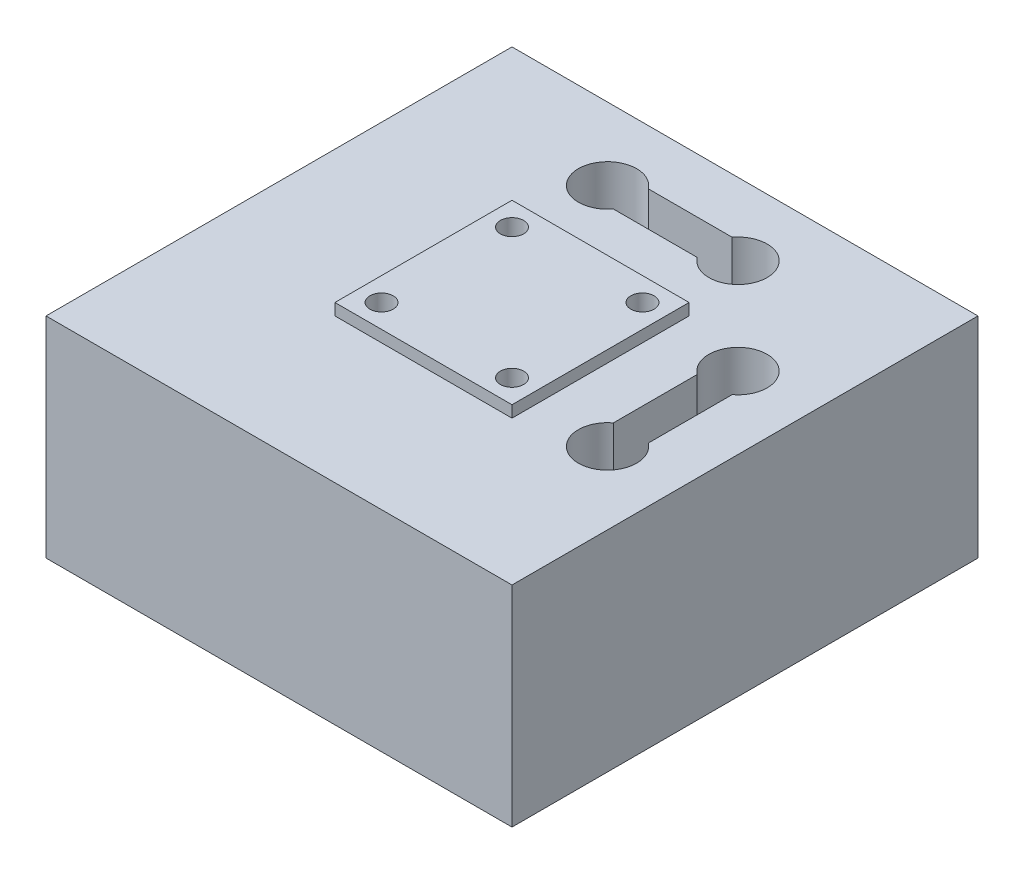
SolidWorks part; units mm, degrees
ref_plane "Front Plane" through (0, 0, 0) normal (0, 0, 1) x (1, 0, 0)
ref_plane "Top Plane" through (0, 0, 0) normal (0, 1, 0) x (1, 0, 0)
ref_plane "Right Plane" through (0, 0, 0) normal (1, 0, 0) x (0, 0, -1)
sketch "Sketch1" plane through (0, 0, 0) normal (0, 1, 0) x (1, 0, 0)
  line L1 (0, 0) -> (40, 0)
  line L2 (0, 0) -> (0, 40)
  line L3 (0, 40) -> (40, 40)
  line L4 (40, 0) -> (40, 40)
  dimension "D1" = 40
extrude "Boss-Extrude1" add sketch "Sketch1" along normal blind 18
sketch "Sketch2" plane through (0, 18, 0) normal (0, 1, 0) x (1, 0, 0)
  line L0 (0, 27.6) -> (12.4, 27.6) construction
  line L1 (12.4, 12.4) -> (27.6, 12.4)
  line L2 (12.4, 12.4) -> (12.4, 27.6)
  line L3 (12.4, 27.6) -> (27.6, 27.6)
  line L4 (27.6, 12.4) -> (27.6, 27.6)
  line L5 (0, 40) -> (0, 0) construction
  line L6 (12.4, 27.6) -> (12.4, 40) construction
  line L7 (40, 40) -> (0, 40) construction
  line L8 (40, 12.4) -> (27.6, 12.4) construction
  line L9 (40, 0) -> (40, 40) construction
  line L10 (27.6, 0) -> (27.6, 12.4) construction
  line L11 (0, 0) -> (40, 0) construction
  dimension "D1" = 15.2
extrude "Boss-Extrude2" add sketch "Sketch2" along normal blind 1 and the other way blind 19
sketch "Sketch3" plane through (0, 19, 0) normal (0, 1, 0) x (1, 0, 0)
  line L0 (12.4, 12.4) -> (27.6, 12.4) construction
  line L1 (14.4, 14.4) -> (25.6, 14.4) construction
  line L2 (14.4, 14.4) -> (14.4, 25.6) construction
  line L3 (14.4, 25.6) -> (25.6, 25.6) construction
  line L4 (25.6, 14.4) -> (25.6, 25.6) construction
  line L5 (12.4, 27.6) -> (12.4, 12.4) construction
  line L6 (27.6, 12.4) -> (27.6, 27.6) construction
  line L7 (14.4, 27.6) -> (14.4, 40) construction
  line L8 (12.4, 27.6) -> (27.6, 27.6) construction
  line L9 (40, 40) -> (0, 40) construction
  line L10 (25.6, 27.6) -> (25.6, 40) construction
  line L11 (27.6, 27.6) -> (12.4, 27.6) construction
  line L12 (27.6, 25.6) -> (40, 25.6) construction
  line L13 (27.6, 27.6) -> (27.6, 12.4) construction
  line L14 (40, 0) -> (40, 40) construction
  line L15 (27.6, 14.4) -> (40, 14.4) construction
  line L17 (14.4, 35.3) -> (25.6, 35.3)
  line L18 (14.4, 35.3) -> (14.4, 32.3)
  line L19 (14.4, 32.3) -> (25.6, 32.3)
  line L20 (25.6, 35.3) -> (25.6, 32.3)
  line L21 (32.3, 25.6) -> (35.3, 25.6)
  line L22 (32.3, 25.6) -> (32.3, 14.4)
  line L23 (32.3, 14.4) -> (35.3, 14.4)
  line L24 (35.3, 25.6) -> (35.3, 14.4)
  circle A0 centre (14.4, 25.6) radius 1
  circle A1 centre (25.6, 25.6) radius 1
  circle A2 centre (25.6, 14.4) radius 1
  circle A3 centre (14.4, 14.4) radius 1
  circle A4 centre (14.4, 33.8) radius 2.5
  circle A5 centre (25.6, 33.8) radius 2.5
  circle A6 centre (33.8, 25.6) radius 2.5
  circle A7 centre (33.8, 14.4) radius 2.5
  point P48 (14.4, 33.8)
  point P49 (25.6, 33.8)
  point P50 (33.8, 25.6)
  point P51 (20, 32.3)
  dimension "D4" = 2
  dimension "D5" = 5
  dimension "D1" = 2
  dimension "D2" = 2
  dimension "D3" = 2
  dimension "D6" = 3
extrude "Cut-Extrude1" cut sketch "Sketch3" against normal through all contours L17 A4 L19 L18 | L19 A4 L17 L18 | A5 L17 A4 L19 | L17 A5 L19 L20 | L19 A5 L17 L20 | L24 A6 L22 L21 | L22 A6 L24 L21 | A7 L24 A6 L22 | L24 A7 L22 L23 | L22 A7 L24 L23 | A2 | A1 | A0 | A3
